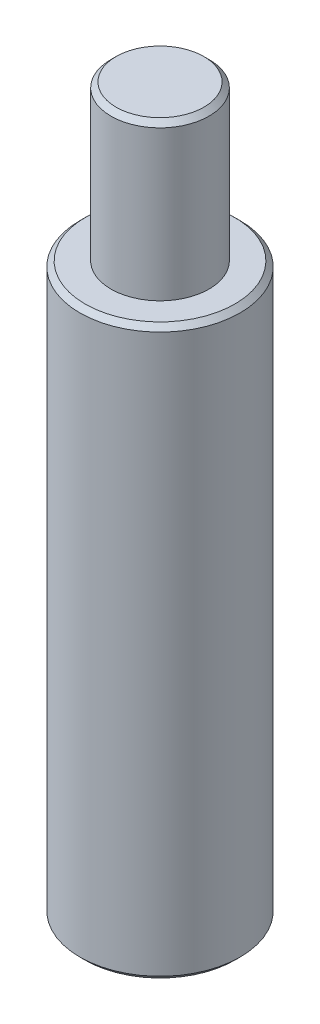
SolidWorks part; units mm, degrees
ref_plane "Front Plane" through (0, 0, 0) normal (0, 0, 1) x (1, 0, 0)
ref_plane "Top Plane" through (0, 0, 0) normal (0, 1, 0) x (1, 0, 0)
ref_plane "Right Plane" through (0, 0, 0) normal (1, 0, 0) x (0, 0, -1)
sketch "Sketch1" plane through (0, 0, 0) normal (0, 1, 0) x (1, 0, 0)
  circle A0 centre (0, 0) radius 1.55
  dimension "D1" = 3.1
extrude "Boss-Extrude1" add sketch "Sketch1" along normal blind 11
sketch "Sketch2" plane through (0, 11, 0) normal (0, 1, 0) x (1, 0, 0)
  circle A0 centre (0, 0) radius 0.95
  dimension "D1" = 1.9
extrude "Boss-Extrude2" add sketch "Sketch2" along normal blind 3
hole_wizard "Tap Drill for M2 Tap1" positions "Sketch3" profile "Sketch5" hole size "M2" standard "ISO"
sketch "Sketch3" plane through (0, 0, 0) normal (0, -1, 0) x (-1, 0, 0)
  point P0 (0, 0)
sketch "Sketch5" plane through (0, 0, 0) normal (1, 0, 0) x (0, 0, -1)
  line L0 (0, 0) -> (0, 8.4807)
  line L1 (0, 8.4807) -> (0.8, 8)
  line L2 (0.8, 8) -> (0.8, 0)
  line L5 (0.8, 0) -> (0, 0)
  line L10 (0, 8.4807) -> (-0.8, 8) construction
  line L11 (0, -6.35) -> (0, 107.95) construction
  dimension "Hole Dia." = 1.6
  dimension "Hole Depth" = 8
  dimension "Drill Angle" = 118
chamfer "Chamfer1" distance 0.1 angle 45 3 edges at (0, 0, 1.55) (0, 11, 1.55) (0, 14, 0.95)
